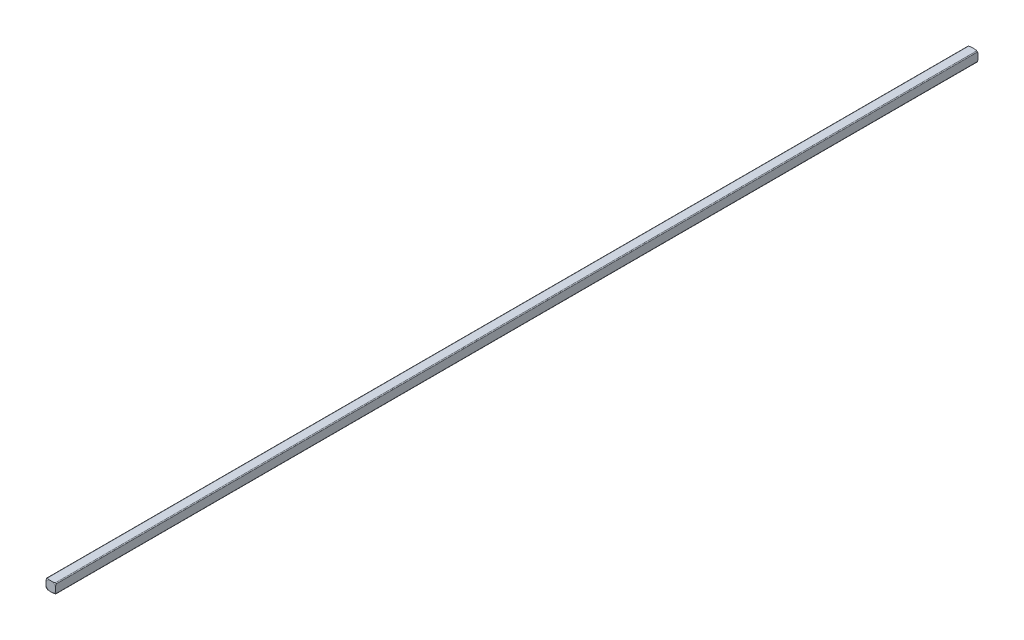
SolidWorks part; units mm, degrees
ref_plane "Front" through (0, 0, 0) normal (0, 0, 1) x (1, 0, 0)
ref_plane "Top" through (0, 0, 0) normal (0, 1, 0) x (1, 0, 0)
ref_plane "Right" through (0, 0, 0) normal (1, 0, 0) x (0, 0, -1)
imported_body "Imported3"
fillet "Fillet1" radius 0.254
